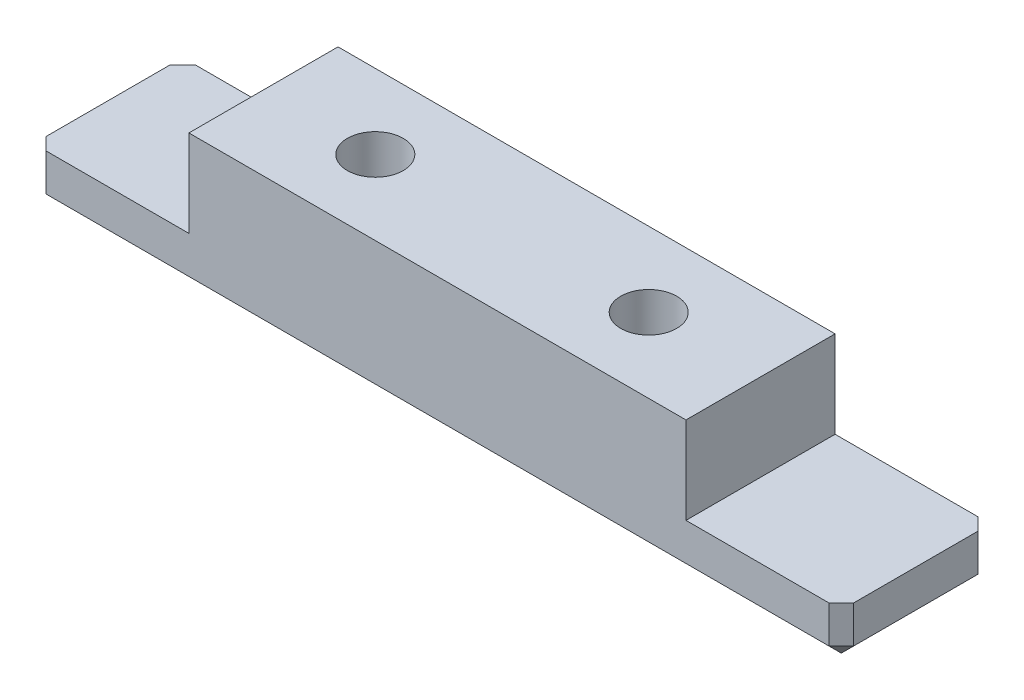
SolidWorks part; units mm, degrees
ref_plane "Face" through (0, 0, 0) normal (0, 0, 1) x (1, 0, 0)
ref_plane "Dessus" through (0, 0, 0) normal (0, 1, 0) x (1, 0, 0)
ref_plane "Profil" through (0, 0, 0) normal (1, 0, 0) x (0, 0, -1)
sketch "Esquisse1" plane through (0, 0, 0) normal (0, 0, 1) x (1, 0, 0)
  line L0 (-20, 0) -> (20, 0)
  line L1 (0, 15.5438) -> (0, -11.0048) construction
  line L2 (20, 0) -> (20, -7)
  line L3 (-20, 0) -> (-20, -7)
  line L4 (20, -7) -> (32.5, -7)
  line L5 (-20, -7) -> (-32.5, -7)
  line L6 (32.5, -7) -> (32.5, -11.0048)
  line L7 (-32.5, -7) -> (-32.5, -11.0048)
  line L8 (32.5, -11.0048) -> (-32.5, -11.0048)
  point P4 (0, 0)
  dimension "D1" = 40
  dimension "D2" = 65
  dimension "D3" = 7
extrude "Base-Extrusion" add sketch "Esquisse1" along normal mid plane 12
chamfer "Chanfrein1" distance 1 angle 45
hole_wizard "Perçage1" positions "Esquisse4" profile "Esquisse3" hole size "M4" standard "ISO"
sketch "Esquisse4" plane through (0, -11.0048, 0) normal (0, -1, 0) x (1, 0, 0)
  point P0 (11, 0)
  dimension "D1" = 11
sketch "Esquisse3" plane through (11, -11.0048, 0) normal (1, 0, 0) x (0, 0, -1)
  line L0 (0, 0) -> (0, 11.0048)
  line L1 (0, 11.0048) -> (2.25, 11.0048)
  line L2 (2.25, 11.0048) -> (2.25, 0)
  line L5 (2.25, 0) -> (0, 0)
  line L11 (0, -6.35) -> (0, 107.95) construction
  dimension "Diamètre du perçage jusqu'au prochain" = 4.5
  dimension "Profondeur du perçage jusqu'au prochain" = 11.0048
pattern_linear "Répétition linéaire1" count 2 spacing 22
